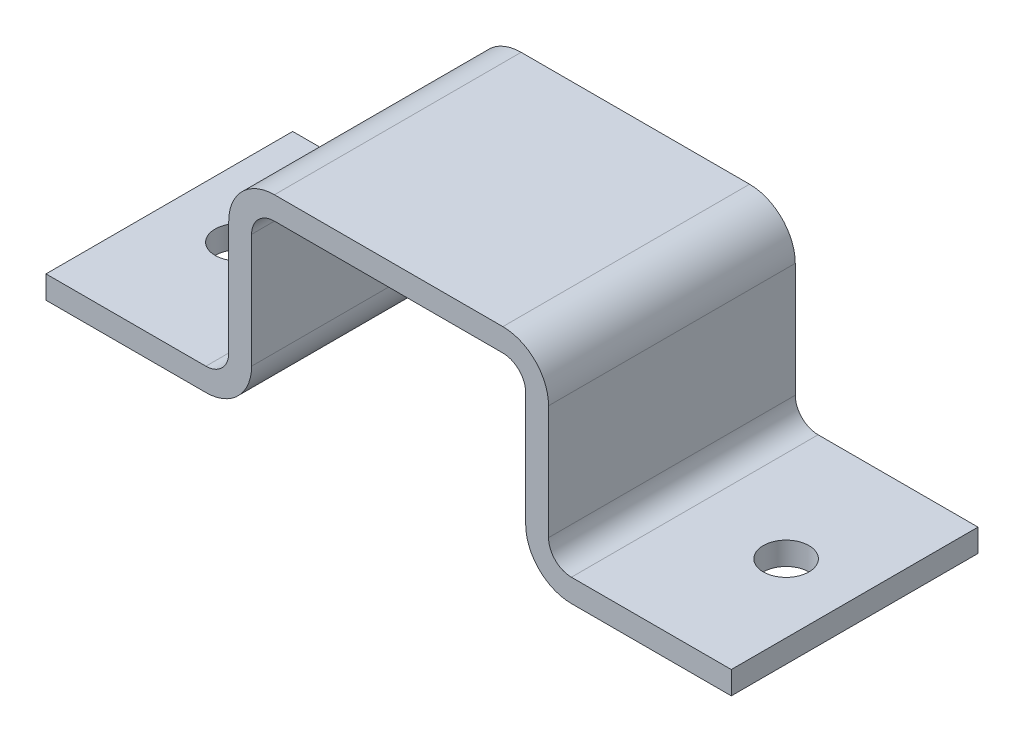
SolidWorks part; units mm, degrees
ref_plane "Front" through (0, 0, 0) normal (0, 0, 1) x (1, 0, 0)
ref_plane "Top" through (0, 0, 0) normal (0, 1, 0) x (1, 0, 0)
ref_plane "Right" through (0, 0, 0) normal (1, 0, 0) x (0, 0, -1)
sketch "Sketch3" plane through (0, 0, 0) normal (0, 0, 1) x (1, 0, 0)
  line L0 (-75, -40) -> (-30, -40)
  line L1 (-30, -40) -> (-30, 0)
  line L2 (-30, 0) -> (30, 0)
  line L3 (30, 0) -> (30, -40)
  line L4 (30, -40) -> (75, -40)
  line L5 (0, 0) -> (0, 34.0487) construction
  point P9 (0, 0)
  dimension "D1" = 60
  dimension "D2" = 40
  dimension "D3" = 45
extrude "Extrude-Thin1" add sketch "Sketch3" along normal mid plane 54 thin
sketch "Sketch4" plane through (0, -35, 0) normal (0, 1, 0) x (1, 0, 0)
  line L0 (-75, -27) -> (-75, 27) construction
  line L1 (-60, 0) -> (0, 0) construction
  circle A0 centre (-60, 0) radius 5
  dimension "D1" = 10
  dimension "D2" = 15
extrude "Cut-Extrude1" cut sketch "Sketch4" against normal up to next
mirror "Mirror1" about plane through (0, 0, 0) normal (1, 0, 0) of "Cut-Extrude1"
